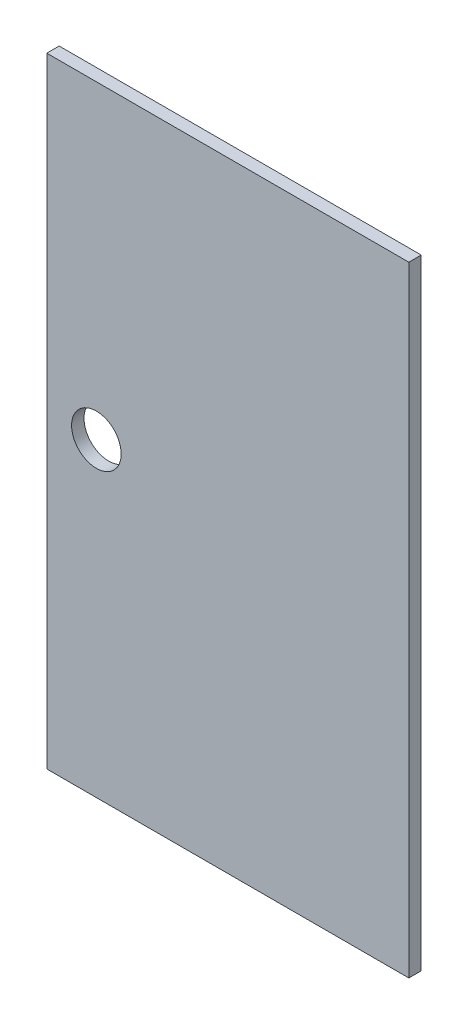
SolidWorks part; units mm, degrees
ref_plane "Front Plane" through (0, 0, 0) normal (0, 0, 1) x (1, 0, 0)
ref_plane "Top Plane" through (0, 0, 0) normal (0, 1, 0) x (1, 0, 0)
ref_plane "Right Plane" through (0, 0, 0) normal (1, 0, 0) x (0, 0, -1)
sketch "Sketch1" plane through (0, 0, 0) normal (0, 1, 0) x (1, 0, 0)
  line L1 (-146, -5) -> (146, -5)
  line L2 (-146, -5) -> (-146, 5)
  line L3 (-146, 5) -> (146, 5)
  line L4 (146, -5) -> (146, 5)
  line L5 (-146, -5) -> (146, 5) construction
  line L6 (-146, 5) -> (146, -5) construction
  point P0 (0, 0)
  dimension "D1" = 10
  dimension "D2" = 292
extrude "Boss-Extrude1" add sketch "Sketch1" along normal blind 500
sketch "Sketch2" plane through (0, 0, 5) normal (0, 0, 1) x (1, 0, 0)
  line L0 (-146, 500) -> (146, 500) construction
  line L1 (-146, 500) -> (-146, 0) construction
  circle A0 centre (-106, 250) radius 20
  dimension "D1" = 40
  dimension "D2" = 250
  dimension "D3" = 40
extrude "Cut-Extrude1" cut sketch "Sketch2" against normal blind 271
